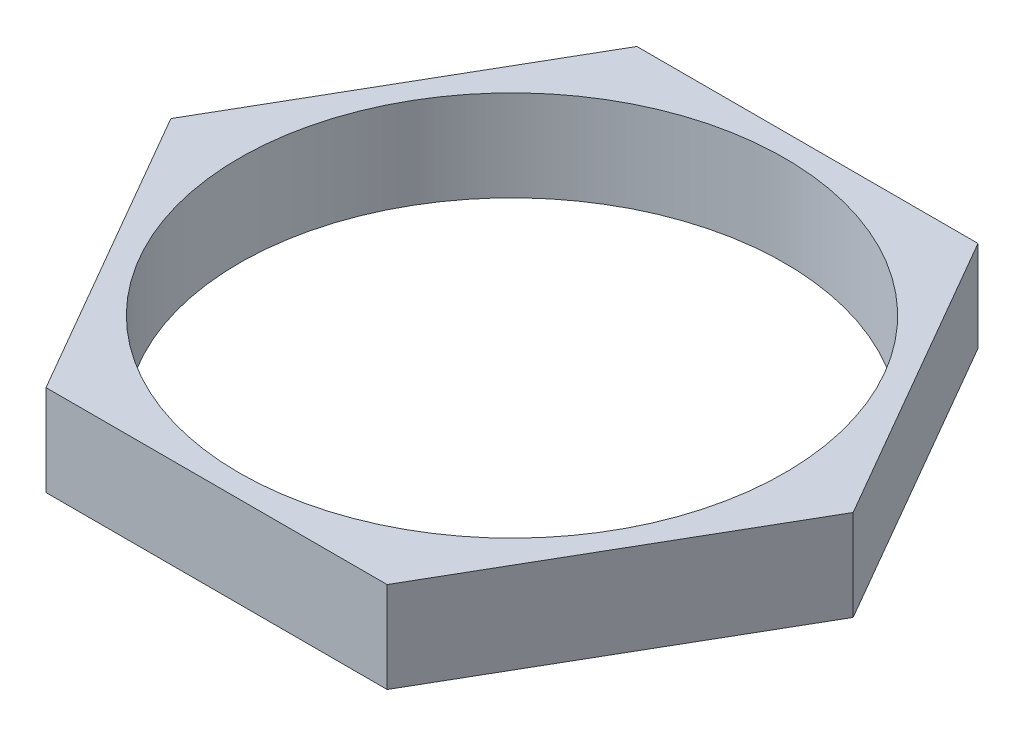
SolidWorks part; units mm, degrees
ref_plane "Plan de face" through (0, 0, 0) normal (0, 0, 1) x (1, 0, 0)
ref_plane "Plan de dessus" through (0, 0, 0) normal (0, 1, 0) x (1, 0, 0)
ref_plane "Plan de droite" through (0, 0, 0) normal (1, 0, 0) x (0, 0, -1)
sketch "Esquisse1" plane through (0, 0, 0) normal (0, 1, 0) x (1, 0, 0)
  line L1 (5.6292, -9.75) -> (11.2583, 0)
  line L2 (11.2583, 0) -> (5.6292, 9.75)
  line L3 (5.6292, 9.75) -> (-5.6292, 9.75)
  line L4 (-5.6292, 9.75) -> (-11.2583, 0)
  line L5 (-11.2583, 0) -> (-5.6292, -9.75)
  line L6 (-5.6292, -9.75) -> (5.6292, -9.75)
  circle A0 centre (0, 0) radius 9.75 construction
  circle A1 centre (0, 0) radius 9
  dimension "D2" = 18
  dimension "D1" = 19.5
extrude "Extrusion1" add sketch "Esquisse1" along normal blind 3
